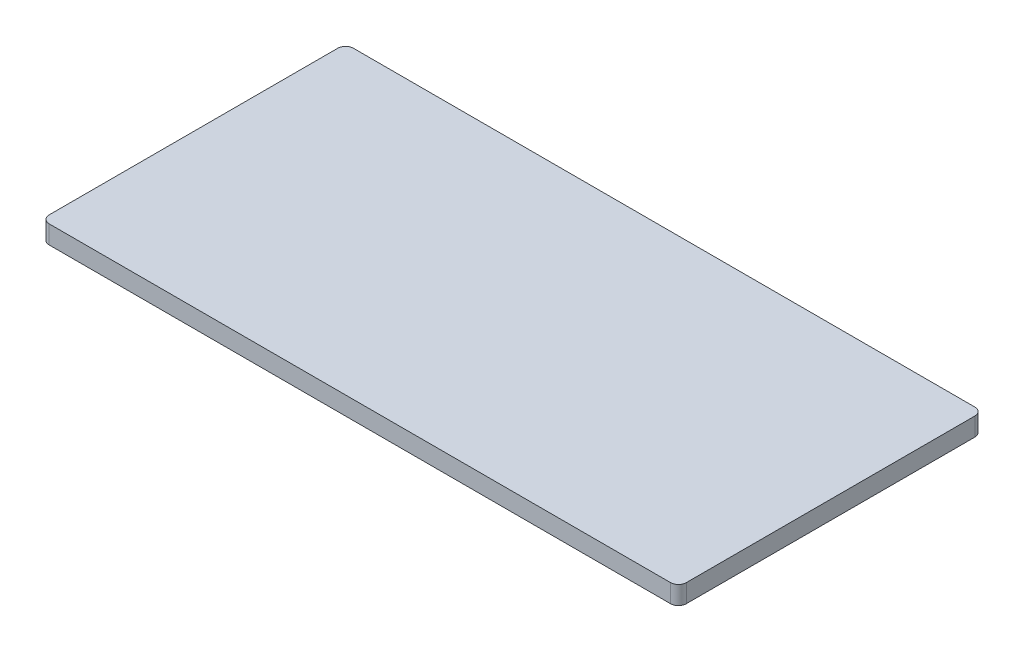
SolidWorks part; units mm, degrees
ref_plane "Front Plane" through (0, 0, 0) normal (0, 0, 1) x (1, 0, 0)
ref_plane "Top Plane" through (0, 0, 0) normal (0, 1, 0) x (1, 0, 0)
ref_plane "Right Plane" through (0, 0, 0) normal (1, 0, 0) x (0, 0, -1)
sketch "Sketch1" plane through (0, 0, 0) normal (0, 1, 0) x (1, 0, 0)
  line L1 (-560, 280) -> (560, 280)
  line L2 (-580, 260) -> (-580, -260)
  line L3 (-560, -280) -> (560, -280)
  line L4 (580, 260) -> (580, -260)
  line L5 (-580, 280) -> (580, -280) construction
  line L6 (-580, -280) -> (580, 280) construction
  arc A0 (560, 280) -> (580, 260) centre (560, 260) cw
  arc A1 (-580, -260) -> (-560, -280) centre (-560, -260) ccw
  arc A2 (-560, 280) -> (-580, 260) centre (-560, 260) ccw
  arc A3 (560, -280) -> (580, -260) centre (560, -260) ccw
  point P0 (0, 0)
  dimension "D3" = 20
  dimension "D1" = 560
  dimension "D2" = 1160
extrude "Boss-Extrude1" add sketch "Sketch1" against normal blind 5 draft 45
sketch "Sketch2" plane through (0, 0, 0) normal (0, 1, 0) x (1, 0, 0)
  line L1 (-600, 300) -> (600, 300)
  line L2 (-600, 300) -> (-600, -300)
  line L3 (-600, -300) -> (600, -300)
  line L4 (600, 300) -> (600, -300)
  line L5 (-600, 300) -> (600, -300) construction
  line L6 (-600, -300) -> (600, 300) construction
  point P0 (0, 0)
  dimension "D1" = 600
  dimension "D2" = 1200
extrude "Boss-Extrude2" add sketch "Sketch2" along normal blind 28
fillet "Fillet1" radius 2 16 edges at (-574.1421, 0, 274.1421) (-580, 0, 0) (-574.1421, 0, -274.1421) (0, 0, -280) (574.1421, 0, -274.1421) (580, 0, 0) (574.1421, 0, 274.1421) (0, -5, -275) (-570.6066, -5, -270.6066) (-575, -5, 0) (-570.6066, -5, 270.6066) (0, -5, 275) (570.6066, -5, 270.6066) (575, -5, 0) (570.6066, -5, -270.6066) (0, 0, 280)
sketch "Sketch5" plane through (0, -5, 0) normal (0, -1, 0) x (1, 0, 0)
  line L4 (-560, -274.1716) -> (560, -274.1716)
  line L5 (574.1716, -260) -> (574.1716, 260)
  line L6 (560, 274.1716) -> (-560, 274.1716)
  line L7 (-574.1716, 260) -> (-574.1716, -260)
  line L8 (-560, -274.1716) -> (560, -274.1716)
  line L9 (574.1716, -260) -> (574.1716, 260)
  line L10 (560, 274.1716) -> (-560, 274.1716)
  line L11 (-574.1716, 260) -> (-574.1716, -260)
  arc A4 (-574.1716, -260) -> (-560, -274.1716) centre (-560, -260) ccw
  arc A5 (560, -274.1716) -> (574.1716, -260) centre (560, -260) ccw
  arc A6 (574.1716, 260) -> (560, 274.1716) centre (560, 260) ccw
  arc A7 (-560, 274.1716) -> (-574.1716, 260) centre (-560, 260) ccw
  arc A8 (-574.1716, -260) -> (-560, -274.1716) centre (-560, -260) ccw
  arc A9 (560, -274.1716) -> (574.1716, -260) centre (560, -260) ccw
  arc A10 (574.1716, 260) -> (560, 274.1716) centre (560, 260) ccw
  arc A11 (-560, 274.1716) -> (-574.1716, 260) centre (-560, 260) ccw
  dimension "D1" = 0
extrude "Cut-Extrude1" cut sketch "Sketch5" against normal through all flip side to cut
sketch "Sketch6" plane through (0, -5, 0) normal (0, -1, 0) x (1, 0, 0)
  line L0 (-574.1716, 260) -> (-574.1716, -260) construction
  line L1 (539.1716, 259.1716) -> (108.8932, 259.1716)
  line L2 (559.1716, 239.1716) -> (559.1716, -239.1716)
  line L3 (539.1716, -259.1716) -> (-539.1716, -259.1716)
  line L4 (-559.1716, 239.1716) -> (-559.1716, -239.1716)
  line L5 (559.1716, 259.1716) -> (-559.1716, -259.1716) construction
  line L6 (559.1716, -259.1716) -> (-559.1716, 259.1716) construction
  line L7 (560, 274.1716) -> (-560, 274.1716) construction
  line L8 (0, 0) -> (0, 259.1716) construction
  line L9 (92.5436, 254.3249) -> (16.3497, 204.7988)
  line L10 (-16.3497, 204.7988) -> (-92.5436, 254.3249)
  line L11 (-108.8932, 259.1716) -> (-539.1716, 259.1716)
  arc A0 (-539.1716, 259.1716) -> (-559.1716, 239.1716) centre (-539.1716, 239.1716) ccw
  arc A1 (559.1716, -239.1716) -> (539.1716, -259.1716) centre (539.1716, -239.1716) cw
  arc A2 (539.1716, 259.1716) -> (559.1716, 239.1716) centre (539.1716, 239.1716) cw
  arc A3 (-539.1716, -259.1716) -> (-559.1716, -239.1716) centre (-539.1716, -239.1716) cw
  arc A4 (16.3497, 204.7988) -> (-16.3497, 204.7988) centre (0, 229.9522) cw
  arc A5 (92.5436, 254.3249) -> (108.8932, 259.1716) centre (108.8932, 229.1716) cw
  arc A6 (-92.5436, 254.3249) -> (-108.8932, 259.1716) centre (-108.8932, 229.1716) ccw
  point P0 (0, 0)
  point P29 (0, 194.1716)
  point P32 (100, 259.1716)
  point P35 (-100, 259.1716)
  dimension "D3" = 20
  dimension "D6" = 30
  dimension "D7" = 30
  dimension "D1" = 15
  dimension "D2" = 15
  dimension "D4" = 200
  dimension "D5" = 65
extrude "Boss-Extrude3" add sketch "Sketch6" along normal blind 4 draft 45
fillet "Fillet2" radius 2 28 edges at (553.3137, -5, 253.3137) (559.1716, -5, 0) (553.3137, -5, -253.3137) (0, -5, -259.1716) (-553.3137, -5, -253.3137) (-559.1716, -5, 0) (-553.3137, -5, 253.3137) (-324.0324, -5, 259.1716) (-100.3668, -5, 257.9344) (-54.4466, -5, 229.5619) (0, -5, 199.9522) (54.4466, -5, 229.5619) (100.3668, -5, 257.9344) (-324.0324, -9, 255.1716) (-101.5036, -9, 254.0993) (-56.6266, -9, 226.2081) (0, -9, 195.9522) (56.6266, -9, 226.2081) (101.5036, -9, 254.0993) (324.0324, -9, 255.1716) (550.4853, -9, 250.4853) (555.1716, -9, 0) (550.4853, -9, -250.4853) (0, -9, -255.1716) (-550.4853, -9, -250.4853) (-555.1716, -9, 0) (-550.4853, -9, 250.4853) (324.0324, -5, 259.1716)
sketch "Orientation Sketch" plane through (0, -5, 0) normal (0, -1, 0) x (-1, 0, 0)
  line L0 (-108.8932, -260) -> (-539.1716, -260) construction
  line L1 (-560, -239.1716) -> (-560, 239.1716) construction
  line L2 (-539.1716, 260) -> (539.1716, 260) construction
  line L3 (560, 239.1716) -> (560, -239.1716) construction
  line L4 (539.1716, -260) -> (108.8932, -260) construction
  line L5 (92.0921, -255.0195) -> (15.8982, -205.4934) construction
  line L6 (-15.8982, -205.4934) -> (-92.0921, -255.0195) construction
  line L7 (560, 274.1716) -> (-560, 274.1716) construction
  line L8 (-574.1716, 260) -> (-574.1716, -260) construction
  line L9 (-560, -274.1716) -> (560, -274.1716) construction
  line L10 (574.1716, -260) -> (574.1716, 260) construction
  line L11 (-108.8932, -260) -> (-539.1716, -260)
  line L12 (-560, -239.1716) -> (-560, 239.1716)
  line L13 (-539.1716, 260) -> (539.1716, 260)
  line L14 (560, 239.1716) -> (560, -239.1716)
  line L15 (539.1716, -260) -> (108.8932, -260)
  line L16 (92.0921, -255.0195) -> (15.8982, -205.4934)
  line L17 (-15.8982, -205.4934) -> (-92.0921, -255.0195)
  line L18 (560, 274.1716) -> (-560, 274.1716) construction
  line L19 (-574.1716, 260) -> (-574.1716, -260) construction
  line L20 (-560, -274.1716) -> (560, -274.1716) construction
  line L21 (574.1716, -260) -> (574.1716, 260) construction
  arc A0 (-560, -239.1716) -> (-539.1716, -260) centre (-539.1716, -239.1716) ccw construction
  arc A1 (-539.1716, 260) -> (-560, 239.1716) centre (-539.1716, 239.1716) ccw construction
  arc A2 (560, 239.1716) -> (539.1716, 260) centre (539.1716, 239.1716) ccw construction
  arc A3 (539.1716, -260) -> (560, -239.1716) centre (539.1716, -239.1716) ccw construction
  arc A4 (92.0921, -255.0195) -> (108.8932, -260) centre (108.8932, -229.1716) ccw construction
  arc A5 (15.8982, -205.4934) -> (-15.8982, -205.4934) centre (0, -229.9522) ccw construction
  arc A6 (-108.8932, -260) -> (-92.0921, -255.0195) centre (-108.8932, -229.1716) ccw construction
  arc A7 (574.1716, 260) -> (560, 274.1716) centre (560, 260) ccw construction
  arc A8 (-560, 274.1716) -> (-574.1716, 260) centre (-560, 260) ccw construction
  arc A9 (-574.1716, -260) -> (-560, -274.1716) centre (-560, -260) ccw construction
  arc A10 (560, -274.1716) -> (574.1716, -260) centre (560, -260) ccw construction
  arc A11 (-560, -239.1716) -> (-539.1716, -260) centre (-539.1716, -239.1716) ccw
  arc A12 (-539.1716, 260) -> (-560, 239.1716) centre (-539.1716, 239.1716) ccw
  arc A13 (560, 239.1716) -> (539.1716, 260) centre (539.1716, 239.1716) ccw
  arc A14 (539.1716, -260) -> (560, -239.1716) centre (539.1716, -239.1716) ccw
  arc A15 (92.0921, -255.0195) -> (108.8932, -260) centre (108.8932, -229.1716) ccw
  arc A16 (15.8982, -205.4934) -> (-15.8982, -205.4934) centre (0, -229.9522) ccw
  arc A17 (-108.8932, -260) -> (-92.0921, -255.0195) centre (-108.8932, -229.1716) ccw
  arc A18 (574.1716, 260) -> (560, 274.1716) centre (560, 260) ccw construction
  arc A19 (-560, 274.1716) -> (-574.1716, 260) centre (-560, 260) ccw construction
  arc A20 (-574.1716, -260) -> (-560, -274.1716) centre (-560, -260) ccw construction
  arc A21 (560, -274.1716) -> (574.1716, -260) centre (560, -260) ccw construction
  point P32 (0, 0)
other "FormTool2"
